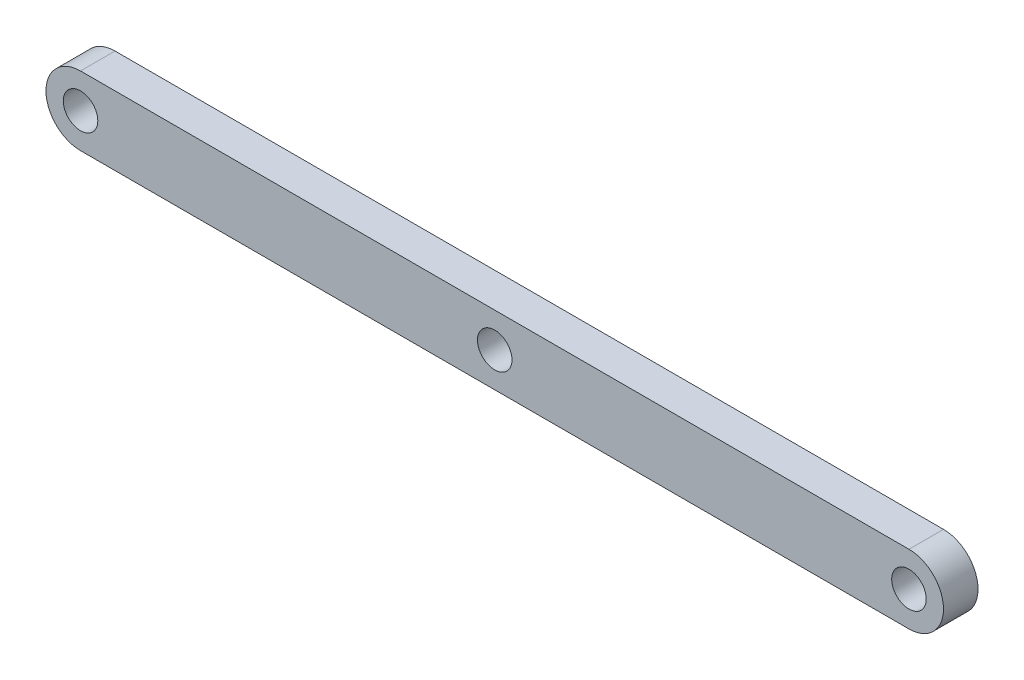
SolidWorks part; units mm, degrees
ref_plane "Front Plane" through (0, 0, 0) normal (0, 0, 1) x (1, 0, 0)
ref_plane "Top Plane" through (0, 0, 0) normal (0, 1, 0) x (1, 0, 0)
ref_plane "Right Plane" through (0, 0, 0) normal (1, 0, 0) x (0, 0, -1)
sketch "Sketch1" plane through (0, 0, 0) normal (0, 0, 1) x (1, 0, 0)
  line L0 (0, 0) -> (76.2, 0) construction
  line L1 (0, 3.175) -> (76.2, 3.175)
  line L2 (0, -3.175) -> (76.2, -3.175)
  arc A0 (0, 3.175) -> (0, -3.175) centre (0, 0) ccw
  arc A1 (76.2, -3.175) -> (76.2, 3.175) centre (76.2, 0) ccw
  circle A2 centre (0, 0) radius 1.5875
  circle A3 centre (76.2, 0) radius 1.5875
  circle A4 centre (38.1, 0) radius 1.5875
  point P3 (38.1, 0)
  dimension "D2" = 3.175
  dimension "D3" = 3.175
  dimension "D1" = 76.2
extrude "Boss-Extrude1" add sketch "Sketch1" along normal blind 3.175
